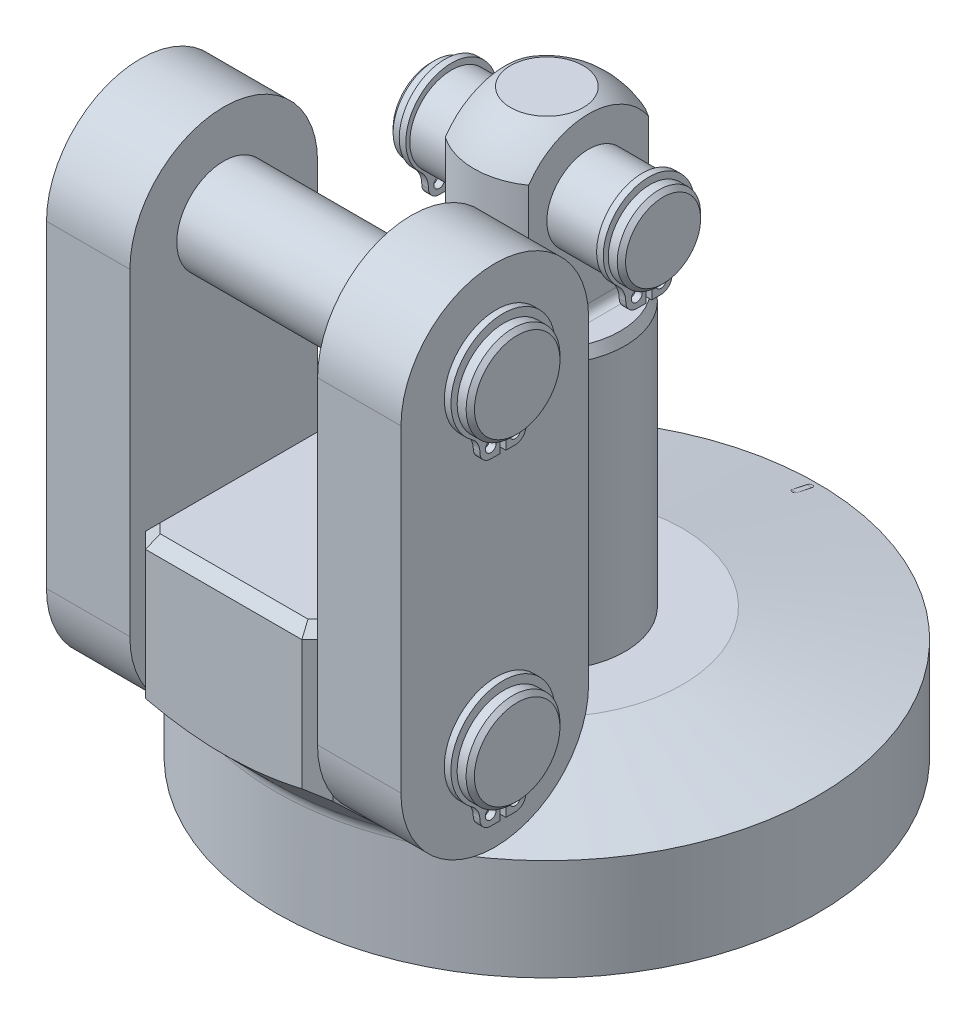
SolidWorks part; units mm, degrees
ref_plane "Front Plane" through (0, 0, 0) normal (0, 0, 1) x (1, 0, 0)
ref_plane "Top Plane" through (0, 0, 0) normal (0, 1, 0) x (1, 0, 0)
ref_plane "Right Plane" through (0, 0, 0) normal (1, 0, 0) x (0, 0, -1)
sketch "Sketch1" plane through (0, 0, 0) normal (0, 1, 0) x (1, 0, 0)
  line L0 (-9, 0) -> (9, 0)
  line L1 (9, 0) -> (9, -31)
  line L2 (9, -31) -> (-9, -31)
  line L3 (-9, -31) -> (-9, 0)
  line L4 (0, 1.05) -> (0, -22.05) construction
  dimension "D1" = 18
  dimension "D2" = 31
extrude "Extrude1" add sketch "Sketch1" along normal blind 30
sketch "S2D0003" plane through (0, 0, 0) normal (1, 0, 0) x (0, 0, -1)
  line L0 (0, 0) -> (0, 12.5)
  line L1 (-31, 0) -> (0, 0)
  line L2 (-31, 0) -> (-31, 8.674)
  line L3 (0, 12.5) -> (-13, 12.5)
  line L4 (-13, 12.5) -> (-31, 8.674)
  line L5 (0, 9.45) -> (0, -2.5987) construction
  line L6 (0, 30) -> (0, 0) construction
  line L8 (-31, 0) -> (0, 0) construction
  line L10 (-31, 30) -> (-31, 0) construction
  dimension "D1" = 12.5
  dimension "D2" = 12
  dimension "D3" = 26
sketch "S2D0004" plane through (0, 0, 0) normal (1, 0, 0) x (0, 0, -1)
  line L0 (-36, 20.7157) -> (-26.4039, 11.1197)
  line L1 (-25.965, 10.06) -> (-25.965, 0)
  line L2 (0, 16.6313) -> (0, -1.1122) construction
  line L3 (0, 30) -> (0, 0) construction
  line L5 (-31, 0) -> (0, 0) construction
  line L6 (-36, 20.7157) -> (-36, 0)
  line L7 (-36, 0) -> (-25.965, 0)
  line L8 (-31, 30) -> (-31, 0) construction
  arc A0 (-25.965, 10.06) -> (-26.4039, 11.1197) centre (-27.4636, 10.06) ccw
  dimension "D4" = 1.4986
  dimension "D1" = 51.93
  dimension "D2" = 10.06
  dimension "D3" = 45
  dimension "D5" = 5
sketch "Sketch4" plane through (0, 0, 0) normal (1, 0, 0) x (0, 0, -1)
  line L0 (0, 12.5) -> (13, 12.5)
  line L1 (13, 12.5) -> (13, 30)
  line L2 (13, 30) -> (0, 30)
  line L3 (0, 30) -> (0, 12.5)
  line L4 (0, 21.6) -> (0, 8.4) construction
  line L5 (0, 30) -> (0, 0) construction
  line L6 (-31, 30) -> (0, 30) construction
  dimension "D1" = 26
  dimension "D2" = 17.5
revolve "Cut-Revolve5" cut sketch "Sketch4" angle 360 about L4
revolve "Revolve1" add sketch "S2D0003" angle 360 about L5
revolve "Cut-Revolve4" cut sketch "S2D0004" angle 360 about L2
sketch "Sketch7" plane through (9, 0, 0) normal (1, 0, 0) x (0, 0, -1)
  line L0 (-25.965, 0) -> (25.965, 0) construction
  circle A0 centre (-22, 21) radius 4.5
  dimension "D1" = 9
  dimension "D2" = 21
  dimension "D3" = 22
extrude "Cut-Extrude3" cut sketch "Sketch7" against normal through all
fillet "Fillet1" radius 2.0066 2 edges at (-9, 21.25, 9.3808) (9, 21.25, 9.3808)
fillet "Fillet2" radius 3.18 5 edges at (-8.0259, 12.2725, 11.5568) (0, 12.5, 13) (7.9617, 12.2867, 11.5199)
chamfer "Chamfer1" distance 1.5 angle 45 2 edges at (-9, 23.4979, 31) (9, 23.4979, 31)
chamfer "Chamfer2" distance 1 angle 45 8 edges at (-9, 30, 21.3887) (-8.0302, 30, 11.5595) (0, 30, 13) (8.0302, 30, 11.5595) (-8.25, 30, 30.25) (9, 30, 21.3887) (8.25, 30, 30.25) (0, 30, 31)
ref_plane "Plane1" through (0, 0, 22) normal (0, 0, 1) x (1, 0, 0)
sketch "Sketch8" plane through (0, 0, 22) normal (0, 0, 1) x (1, 0, 0)
  line L0 (9, 21) -> (9, 11.5)
  line L1 (10.14, 10.36) -> (19.64, 10.36)
  line L2 (19.64, 10.36) -> (19.64, 21)
  line L3 (19.64, 21) -> (9, 21)
  line L4 (5.637, 21) -> (19.4125, 21) construction
  line L5 (-9, 21) -> (9, 21) construction
  line L6 (9, 30) -> (9, 16.9958) construction
  line L7 (0, 0) -> (0, 26.6501) construction
  line L8 (-19.64, 21) -> (-9, 21)
  line L9 (-19.64, 10.36) -> (-19.64, 21)
  line L10 (-10.14, 10.36) -> (-19.64, 10.36)
  line L11 (-9, 21) -> (-9, 11.5)
  arc A0 (9, 11.5) -> (10.14, 10.36) centre (10.14, 11.5) ccw
  arc A1 (-9, 11.5) -> (-10.14, 10.36) centre (-10.14, 11.5) cw
  dimension "D4" = 1.14
  dimension "D2" = 21.28
  dimension "D3" = 10.64
revolve "Cut-Revolve6" cut sketch "Sketch8" angle 360 about L4
sketch "Sketch10" plane through (0, 0, 0) normal (1, 0, 0) x (0, 0, -1)
  line L0 (0, 12.5) -> (0, 55.6918)
  line L1 (0, 55.6918) -> (3.4871, 55.6918)
  line L2 (7, 52.3648) -> (7, 38.9714)
  line L3 (7, 38.9714) -> (7.5, 37.8991)
  line L4 (7.5, 37.8991) -> (7.5, 12.5)
  line L5 (7.5, 12.5) -> (0, 12.5)
  line L6 (0, 44.745) -> (0, 7.55) construction
  line L7 (22.759, -21.0026) -> (-24.5324, -21.0026) construction
  line L9 (13, 12.5) -> (-8.7114, 12.5) construction
  arc A0 (7, 52.3648) -> (3.4871, 55.6918) centre (0, 48.4918) ccw
  circle A1 centre (0, 48.4918) radius 4 construction
  dimension "D2" = 8
  dimension "D3" = 8
  dimension "D5" = 69.4944
  dimension "D1" = 7.2
  dimension "D4" = 33.5026
  dimension "D6" = 15
  dimension "D7" = 14
  dimension "D8" = 25
  dimension "D9" = 17.7927
  dimension "D10" = 25.3991
  dimension "D11" = 43.1918
revolve "Revolve2" add sketch "Sketch10" angle 360 about L6
sketch "Sketch12" plane through (0, 0, 0) normal (0, 0, 1) x (1, 0, 0)
  line L0 (4, 55.6918) -> (7.5, 55.6918)
  line L1 (7.5, 55.6918) -> (7.5, 38.8918)
  line L2 (7.5, 38.8918) -> (4.8, 38.8918)
  line L3 (4, 39.6918) -> (4, 55.6918)
  line L4 (3.4871, 55.6918) -> (-3.4871, 55.6918) construction
  line L5 (7.5, 12.5) -> (7.5, 37.8991) construction
  line L6 (-4, 39.6918) -> (-4, 55.6918)
  line L7 (-7.5, 38.8918) -> (-4.8, 38.8918)
  line L8 (0, 38.525) -> (0, 26.975) construction
  line L9 (-7.5, 55.6918) -> (-7.5, 38.8918)
  line L10 (-4, 55.6918) -> (-7.5, 55.6918)
  arc A0 (4, 39.6918) -> (4.8, 38.8918) centre (4.8, 39.6918) ccw
  arc A1 (-4, 39.6918) -> (-4.8, 38.8918) centre (-4.8, 39.6918) cw
  dimension "D3" = 0.8
  dimension "D1" = 8
  dimension "D2" = 16.8
extrude "Cut-Extrude5" cut sketch "Sketch12" against normal mid plane 16
sketch "Sketch14" plane through (4, 0, 0) normal (1, 0, 0) x (0, 0, -1)
  line L0 (3.4871, 55.6918) -> (-3.4871, 55.6918) construction
  circle A0 centre (0, 48.4918) radius 4
  dimension "D2" = 8
  dimension "D1" = 7.2
extrude "Cut-Extrude7" cut sketch "Sketch14" against normal up to next
sketch "S2D0005" plane through (9, 0, 0) normal (1, 0, 0) x (0, 0, -1)
  line L0 (-30.9949, 51.5015) -> (-31, 21.0015)
  line L1 (-12.9949, 51.4985) -> (-13, 20.9985)
  line L2 (-21.9949, 51.5) -> (-22, 21) construction
  line L3 (0, 48.4918) -> (0.0015, 51.489) construction
  line L4 (0.0015, 51.489) -> (-21.9949, 51.5) construction
  arc A0 (-12.9949, 51.4985) -> (-30.9949, 51.5015) centre (-21.9949, 51.5) ccw
  arc A1 (-31, 21.0015) -> (-13, 20.9985) centre (-22, 21) ccw
  circle A2 centre (-21.9949, 51.5) radius 4.5
  circle A3 centre (-22, 21) radius 4.5
  circle A6 centre (-22, 21) radius 4.5 construction
  dimension "D2" = 30.5
  dimension "D1" = 18
  dimension "D3" = 21.9964
  dimension "D4" = 2.9972
extrude "Extrude2" add sketch "S2D0005" along normal blind 8
sketch "S2D0006" plane through (0, 0, 0) normal (0, 0, 1) x (1, 0, 0)
  line L0 (-9.15, 52.4918) -> (9.15, 52.4918)
  line L1 (11.15, 52.0918) -> (11.15, 48.4918)
  line L2 (10.75, 52.4918) -> (11.15, 52.0918)
  line L3 (9.89, 52.4918) -> (10.75, 52.4918)
  line L4 (9.89, 52.1768) -> (9.89, 52.4918)
  line L5 (9.15, 52.1768) -> (9.89, 52.1768)
  line L6 (9.15, 52.4918) -> (9.15, 52.1768)
  line L7 (11.15, 48.4918) -> (-11.15, 48.4918)
  line L8 (-9.15, 52.4918) -> (-9.15, 52.1768)
  line L9 (-9.15, 52.1768) -> (-9.89, 52.1768)
  line L10 (-9.89, 52.1768) -> (-9.89, 52.4918)
  line L11 (-9.89, 52.4918) -> (-10.75, 52.4918)
  line L12 (-10.75, 52.4918) -> (-11.15, 52.0918)
  line L13 (-11.15, 52.0918) -> (-11.15, 48.4918)
  line L14 (-8.415, 48.4918) -> (8.415, 48.4918) construction
  line L15 (-4, 48.4918) -> (4, 48.4918) construction
  line L16 (0, 40.8686) -> (0, 24.9357) construction
  line L17 (0, 38.9714) -> (0, 52.3648) construction
  line L18 (4, 52.4918) -> (-4, 52.4918) construction
  dimension "D1" = 22.3
  dimension "D3" = 0.74
  dimension "D4" = 7.37
  dimension "D5" = 18.3
  dimension "D6" = 0.4
  dimension "D7" = 45
revolve "Revolve3" add sketch "S2D0006" angle 360 about L14
ref_plane "Plane2" through (0, 0, 22) normal (0, 0, 1) x (1, 0, 0)
sketch "Sketch18" plane through (0, 0, 22) normal (0, 0, 1) x (1, 0, 0)
  line L0 (-17.15, 25.5) -> (17.15, 25.5)
  line L1 (19.15, 25.1) -> (19.15, 21)
  line L2 (18.75, 25.5) -> (19.15, 25.1)
  line L3 (17.89, 25.5) -> (18.75, 25.5)
  line L4 (17.89, 25.19) -> (17.89, 25.5)
  line L5 (17.15, 25.19) -> (17.89, 25.19)
  line L6 (17.15, 25.5) -> (17.15, 25.19)
  line L7 (-17.15, 25.5) -> (-17.15, 25.19)
  line L8 (-17.15, 25.19) -> (-17.89, 25.19)
  line L9 (-17.89, 25.19) -> (-17.89, 25.5)
  line L10 (-17.89, 25.5) -> (-18.75, 25.5)
  line L11 (-18.75, 25.5) -> (-19.15, 25.1)
  line L12 (-19.15, 25.1) -> (-19.15, 21)
  line L13 (-13.915, 21) -> (13.915, 21) construction
  line L14 (-9, 21) -> (17, 21) construction
  line L15 (0, 28.7058) -> (0, -18.8155) construction
  line L16 (-19.15, 21) -> (19.15, 21)
  line L17 (17, 25.5) -> (-9, 25.5) construction
  dimension "D2" = 38.3
  dimension "D3" = 8.38
  dimension "D4" = 0.74
  dimension "D5" = 34.3
  dimension "D6" = 0.4
  dimension "D7" = 45
revolve "Revolve4" add sketch "Sketch18" angle 360 about L13
sketch "Sketch20" plane through (9.15, 0, 0) normal (1, 0, 0) x (0, 0, -1)
  line L0 (0.2762, 42.724) -> (1.169, 42.724)
  line L1 (0.2762, 44.934) -> (0.2762, 42.724)
  line L2 (-0.2763, 44.934) -> (-0.2763, 42.724)
  line L3 (-0.2763, 42.724) -> (-1.169, 42.724)
  line L4 (0, 30.527) -> (0, 23.2449) construction
  arc A0 (0.2762, 44.934) -> (-0.2763, 44.934) centre (0, 48.4918) ccw
  arc A1 (2.9608, 45.4734) -> (-2.9608, 45.4734) centre (0, 48.6984) ccw
  circle A2 centre (0, 48.4918) radius 4 construction
  circle A3 centre (1.169, 43.765) radius 0.5205
  arc A4 (2.21, 43.765) -> (1.169, 42.724) centre (1.169, 43.765) cw
  arc A5 (-2.21, 43.765) -> (-2.9608, 45.4734) centre (-4.5292, 43.765) ccw
  arc A6 (-2.21, 43.765) -> (-1.169, 42.724) centre (-1.169, 43.765) ccw
  circle A7 centre (-1.169, 43.765) radius 0.5205
  arc A8 (2.21, 43.765) -> (2.9608, 45.4734) centre (4.5292, 43.765) cw
  dimension "D1" = 0.5525
  dimension "D2" = 3.5685
  dimension "D3" = 4.3779
  dimension "D4" = 0.2066
  dimension "D6" = 1.041
  dimension "D9" = 1.041
  dimension "D10" = 2.3192
  dimension "D7" = 2.338
  dimension "D8" = 4.7268
extrude "Extrude4" add sketch "Sketch20" along normal blind 0.635
sketch "Sketch21" plane through (17.15, 0, 0) normal (1, 0, 0) x (0, 0, -1)
  line L0 (-21.7248, 14.7352) -> (-20.832, 14.735)
  line L1 (-21.7244, 16.9454) -> (-21.7248, 14.7352)
  line L2 (-22.2769, 16.9454) -> (-22.2773, 14.7353)
  line L3 (-22.2773, 14.7353) -> (-23.17, 14.7354)
  line L4 (-22.0024, 6.7838) -> (-22.0035, 0.3066) construction
  line L5 (-30.9949, 51.5015) -> (-31, 21.0015) construction
  arc A0 (-21.7244, 16.9454) -> (-22.2769, 16.9454) centre (-22, 21) ccw
  arc A1 (-19.0647, 17.2013) -> (-24.9366, 17.2023) centre (-22, 21.2396) ccw
  circle A2 centre (-20.8319, 15.776) radius 0.5205
  arc A3 (-19.7909, 15.7759) -> (-20.832, 14.735) centre (-20.8319, 15.776) cw
  arc A4 (-19.7909, 15.7759) -> (-19.0647, 17.2013) centre (-18.0285, 15.7757) cw
  arc A5 (-24.2109, 15.7766) -> (-24.9366, 17.2023) centre (-25.9733, 15.7771) ccw
  arc A6 (-24.2109, 15.7766) -> (-23.17, 14.7354) centre (-23.1699, 15.7764) ccw
  circle A7 centre (-23.1699, 15.7764) radius 0.5205
  circle A8 centre (-22, 21) radius 4.5 construction
  dimension "D1" = 4.064
  dimension "D2" = 4.9924
  dimension "D3" = 0.2396
  dimension "D7" = 1.041
  dimension "D8" = 1.041
  dimension "D9" = 5.2236
  dimension "D10" = 1.7624
  dimension "D4" = 0.5525
  dimension "D6" = 2.338
extrude "Extrude5" add sketch "Sketch21" along normal blind 0.635
pattern_linear "LPattern1" count 2 spacing 30.5 along (0, 1, -0.0002) of "Extrude5", "Revolve4"
mirror "Mirror1" about plane through (0, 0, 0) normal (1, 0, 0) of "Extrude5", "LPattern1", "Extrude4", "Extrude2"
sketch "Sketch22" plane through (0, 0, 0) normal (1, 0, 0) x (0, 0, -1)
  line L0 (24.2755, 10.8803) -> (26.0312, 10.5071) construction
  line L1 (25.965, 9.7442) -> (13, 12.5) construction
  line L2 (23.5196, 10.264) -> (25.4759, 9.8482) construction
  line L3 (23.922, 10.9554) -> (25.3896, 10.6435) construction
  line L5 (23.7557, 10.1729) -> (25.2233, 9.861)
  line L8 (23.1395, 11.1218) -> (26.1721, 10.4772)
  arc A0 (23.1395, 11.1218) -> (23.7557, 10.1729) centre (23.922, 10.9554) ccw
  arc A1 (25.2233, 9.861) -> (26.1721, 10.4772) centre (25.3896, 10.6435) ccw
  dimension "D1" = 1.6
  dimension "D2" = 0.76
  dimension "D3" = 2
  dimension "D4" = 0.5
revolve "Cut-Revolve7" cut sketch "Sketch22" angle 360 about L8
